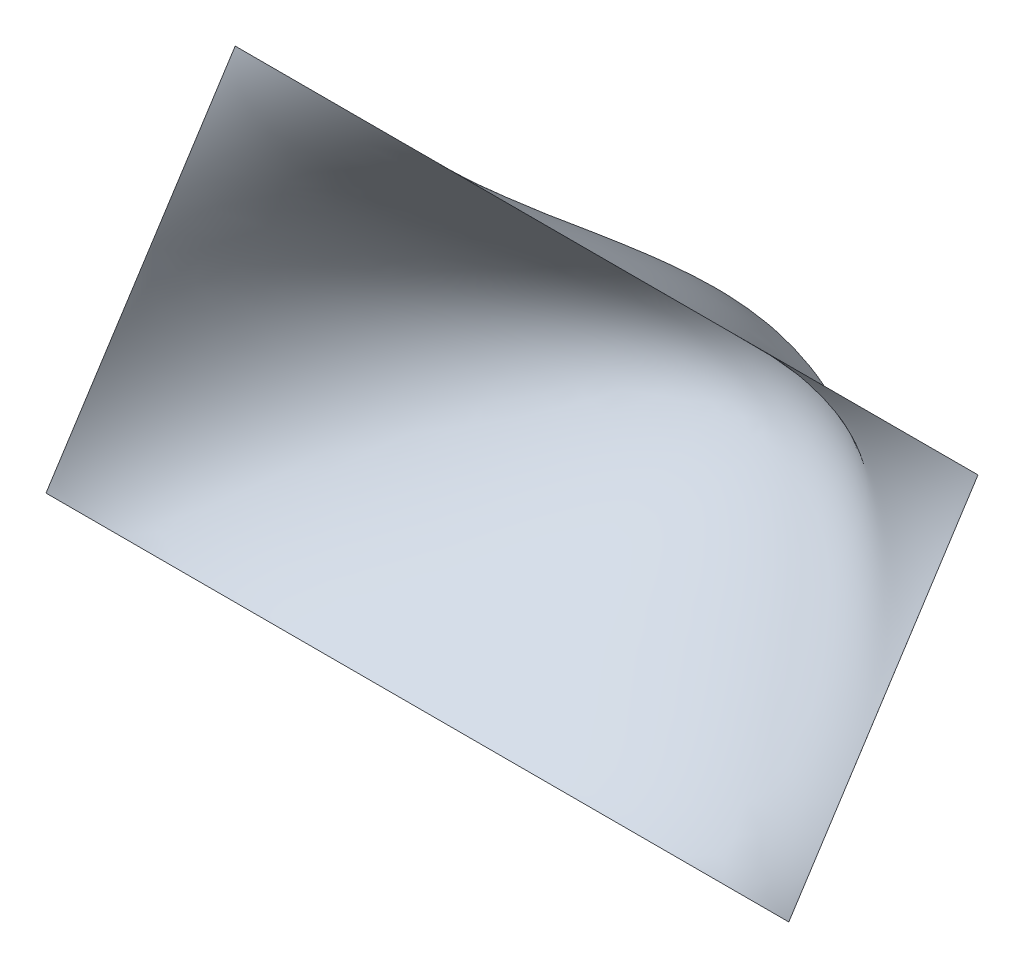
SolidWorks part; units mm, degrees
ref_plane "Ebene vorne" through (0, 0, 0) normal (0, 0, 1) x (1, 0, 0)
ref_plane "Ebene oben" through (0, 0, 0) normal (0, 1, 0) x (1, 0, 0)
ref_plane "Ebene rechts" through (0, 0, 0) normal (1, 0, 0) x (0, 0, -1)
sketch "Skizze1" plane through (0, 0, 0) normal (0, 0, 1) x (1, 0, 0)
  line L0 (0, 0) -> (53.7862, 136.9556)
  line L1 (53.7862, 136.9556) -> (264.9469, 136.9556)
  line L2 (264.9469, 136.9556) -> (211.1607, 0)
  line L3 (211.1607, 0) -> (0, 0)
  line L4 (108.0116, 136.9556) -> (54.2254, 0)
  line L5 (200.7979, 136.9556) -> (147.0117, 0)
  line L6 (38.1508, 97.1433) -> (249.3115, 97.1433)
  line L7 (18.2818, 46.5509) -> (229.4425, 46.5509)
  line L8 (105.5803, 0) -> (159.3666, 136.9556) construction
  line L9 (28.7769, 73.2745) -> (238.0538, 68.4778) construction
ref_plane "Ebene3" through (1.6937, 73.8953, 0) normal (-0.0229, -0.9997, 0) x (0.9997, -0.0229, 0)
ref_plane "Ebene4" through (91.4722, -35.9236, 0) normal (0.9308, -0.3655, 0) x (0, 0, -1)
sketch "Skizze4" plane through (0, 0, 0) normal (0, 0, 1) x (1, 0, 0)
  line L0 (264.9469, 136.9556) -> (211.1607, 0) construction
  line L1 (264.9469, 136.9556) -> (211.1607, 0)
sketch "Skizze5" plane through (0, 0, 0) normal (0, 0, 1) x (1, 0, 0)
  line L0 (0, 0) -> (53.7862, 136.9556) construction
  line L1 (0, 0) -> (53.7862, 136.9556)
sketch "Skizze6" plane through (0, 0, 0) normal (0, 0, 1) x (1, 0, 0)
  line L0 (211.1607, 0) -> (0, 0) construction
  line L1 (211.1607, 0) -> (0, 0)
sketch "Skizze7" plane through (0, 0, 0) normal (0, 0, 1) x (1, 0, 0)
  line L0 (53.7862, 136.9556) -> (264.9469, 136.9556) construction
  line L1 (53.7862, 136.9556) -> (264.9469, 136.9556)
sketch "Skizze2" plane through (1.6937, 73.8953, 0) normal (-0.0229, -0.9997, 0) x (0.9997, -0.0229, 0)
  line L0 (50.6339, 0) -> (261.7391, 0) construction
  line L1 (261.7391, 0) -> (211.1052, 0) construction
  line L2 (27.0903, 0) -> (236.4222, 0) construction
  line L3 (131.7562, 0) -> (131.7562, -113.686) construction
  spline S0 degree 3 poles (236.4222, 0) (201.5335, -33.3644) (131.7562, -100.0931) (61.979, -33.3644) (27.0903, 0) knots 0 0 0 0 0.5 1 1 1 1
sketch "Skizze3" plane through (91.4722, -35.9236, 0) normal (0.9308, -0.3655, 0) x (0, 0, -1)
  spline S0 degree 3 poles (0, 185.7334) (35.4612, 157.3938) (101.9643, 104.2466) (32.4482, 59.4871) (0, 38.5946) knots 0 0 0 0 0.533227 1 1 1 1
surface "Oberfläche-Ausformung2"
equation "\"LÄNGE\"=0"
equation "\"BREITE\"=0"
equation "\"HÖHE\"=0"
equation "\"DURCHMESSER\"=0"
equation "\"Stückzahl\"= 1"
